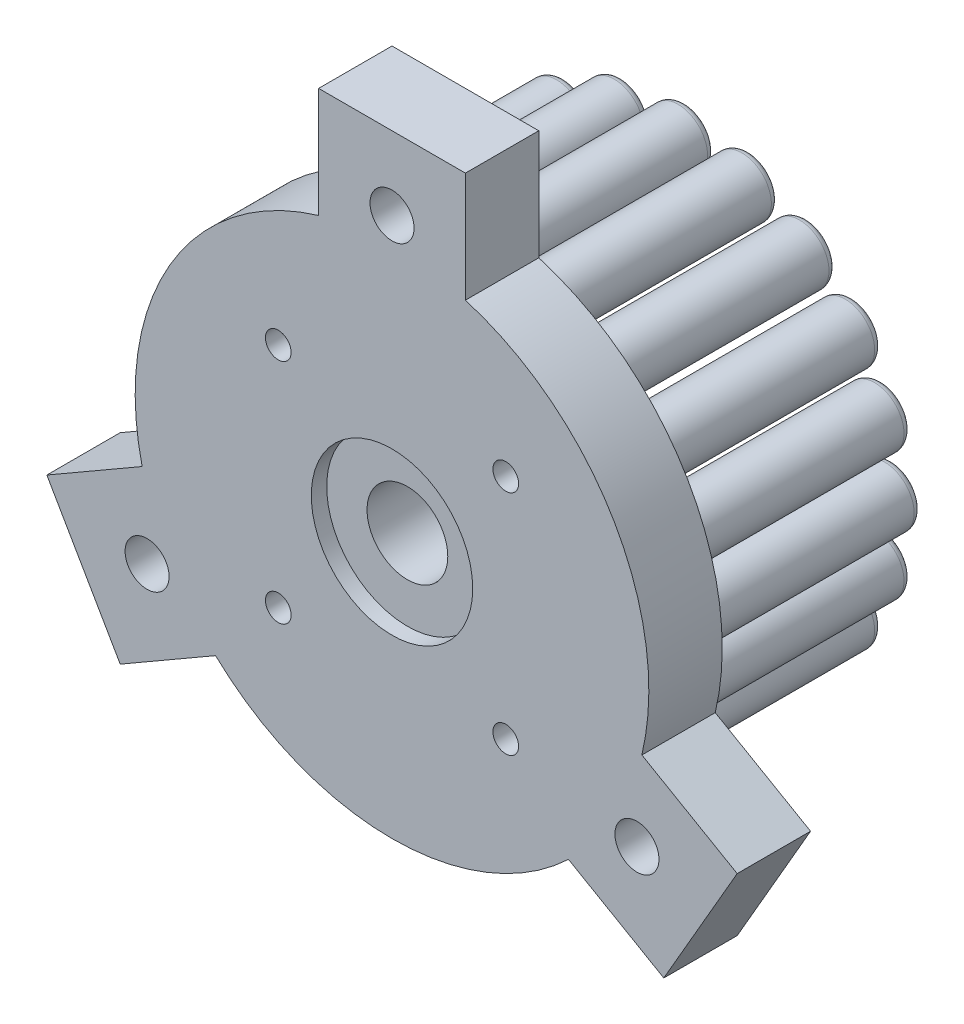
SolidWorks part; units mm, degrees
ref_plane "Ebene vorne" through (0, 0, 0) normal (0, 0, 1) x (1, 0, 0)
ref_plane "Ebene oben" through (0, 0, 0) normal (0, 1, 0) x (1, 0, 0)
ref_plane "Ebene rechts" through (0, 0, 0) normal (1, 0, 0) x (0, 0, -1)
sketch "Skizze1" plane through (0, 0, 0) normal (0, 0, 1) x (1, 0, 0)
  circle A0 centre (0, 0) radius 28.15
  circle A1 centre (0, 28.15) radius 4
  circle A2 centre (8.6988, 26.7722) radius 4
  circle A3 centre (16.5462, 22.7738) radius 4
  circle A4 centre (22.7738, 16.5462) radius 4
  circle A5 centre (26.7722, 8.6988) radius 4
  circle A6 centre (28.15, 0) radius 4
  circle A7 centre (26.7722, -8.6988) radius 4
  circle A8 centre (22.7738, -16.5462) radius 4
  circle A9 centre (16.5462, -22.7738) radius 4
  circle A10 centre (8.6988, -26.7722) radius 4
  circle A11 centre (0, -28.15) radius 4
  circle A12 centre (-8.6988, -26.7722) radius 4
  circle A13 centre (-16.5462, -22.7738) radius 4
  circle A14 centre (-22.7738, -16.5462) radius 4
  circle A15 centre (-26.7722, -8.6988) radius 4
  circle A16 centre (-28.15, 0) radius 4
  circle A17 centre (-26.7722, 8.6988) radius 4
  circle A18 centre (-22.7738, 16.5462) radius 4
  circle A19 centre (-16.5462, 22.7738) radius 4
  circle A20 centre (-8.6988, 26.7722) radius 4
  point P36 (0, 0)
  dimension "D1" = 56.3
  dimension "D2" = 20
  dimension "D3" = 8
extrude "Aufsatz-Linear austragen1" add sketch "Skizze1" along normal blind 30 contours A5 | A4 | A3 | A2 | A1 | A13 | A12 | A11 | A10 | A9 | A8 | A7 | A6 | A14 | A15 | A16 | A17 | A18 | A19 | A20
sketch "Skizze5" plane through (0, 0, 30) normal (0, 0, 1) x (1, 0, 0)
  circle A0 centre (0, 0) radius 35
  dimension "D1" = 70
extrude "Aufsatz-Linear austragen2" add sketch "Skizze5" along normal blind 10
sketch "Skizze6" plane through (0, 0, 40) normal (0, 0, 1) x (1, 0, 0)
  circle A0 centre (0, 0) radius 5.5
  dimension "D1" = 11
extrude "Schnitt-Linear austragen1" cut sketch "Skizze6" against normal blind 10
ref_plane "Ebene2" through (0, 0, 40) normal (0, 0, 1) x (1, 0, 0)
sketch "Skizze7" plane through (0, 0, 40) normal (0, 0, 1) x (1, 0, 0)
  line L1 (-10, 33.541) -> (10, 33.541)
  line L2 (-10, 33.541) -> (-10, 48.541)
  line L3 (-10, 48.541) -> (10, 48.541)
  line L4 (10, 33.541) -> (10, 48.541)
  line L12 (34.0474, -8.1103) -> (47.0378, -15.6103)
  line L13 (34.0474, -8.1103) -> (24.0474, -25.4308)
  line L14 (24.0474, -25.4308) -> (37.0378, -32.9308)
  line L15 (47.0378, -15.6103) -> (37.0378, -32.9308)
  line L16 (-24.0474, -25.4308) -> (-37.0378, -32.9308)
  line L17 (-24.0474, -25.4308) -> (-34.0474, -8.1103)
  line L18 (-34.0474, -8.1103) -> (-47.0378, -15.6103)
  line L19 (-37.0378, -32.9308) -> (-47.0378, -15.6103)
  circle A0 centre (0, 0) radius 35 construction
  point P18 (0, 0)
  dimension "D1" = 20
  dimension "D2" = 10
  dimension "D3" = 15
  dimension "D4" = 3
extrude "Aufsatz-Linear austragen3" add sketch "Skizze7" against normal blind 10
sketch "Skizze9" plane through (0, 0, 40) normal (0, 0, 1) x (1, 0, 0)
  line L0 (10, 48.541) -> (-10, 48.541) construction
  line L1 (10, 33.541) -> (10, 48.541) construction
  circle A0 centre (0, 38.541) radius 3
  circle A1 centre (33.3775, -19.2705) radius 3
  circle A2 centre (-33.3775, -19.2705) radius 3
  point P11 (0, 0)
  dimension "D1" = 6
  dimension "D2" = 10
  dimension "D4" = 10
  dimension "D3" = 3
extrude "Schnitt-Linear austragen3" cut sketch "Skizze9" against normal up to next
fillet "Verrundung2" radius 1 20 edges at (30.7722, 8.6988, 0) (-12.5462, -22.7738, 0) (-4.6988, -26.7722, 0) (4, -28.15, 0) (12.6988, -26.7722, 0) (20.5462, -22.7738, 0) (26.7738, -16.5462, 0) (30.7722, -8.6988, 0) (32.15, 0, 0) (26.7738, 16.5462, 0) (20.5462, 22.7738, 0) (12.6988, 26.7722, 0) (-18.7738, -16.5462, 0) (-22.7722, -8.6988, 0) (-24.15, 0, 0) (-22.7722, 8.6988, 0) (-18.7738, 16.5462, 0) (-12.5462, 22.7738, 0) (-4.6988, 26.7722, 0) (4, 28.15, 0)
sketch "Skizze10" plane through (0, 0, 40) normal (0, 0, 1) x (1, 0, 0)
  line L1 (-15.5, 15.5) -> (15.5, 15.5)
  line L2 (-15.5, 15.5) -> (-15.5, -15.5)
  line L3 (-15.5, -15.5) -> (15.5, -15.5)
  line L4 (15.5, 15.5) -> (15.5, -15.5)
  circle A0 centre (-15.5, 15.5) radius 1.75
  circle A1 centre (15.5, 15.5) radius 1.75
  circle A2 centre (15.5, -15.5) radius 1.75
  circle A3 centre (-15.5, -15.5) radius 1.75
  dimension "D5" = 3.5
  dimension "D1" = 31
  dimension "D2" = 31
  dimension "D3" = 15.5
  dimension "D4" = 15.5
extrude "Schnitt-Linear austragen4" cut sketch "Skizze10" against normal blind 10 contours A1 | A0 | A3 | A2
sketch "Skizze12" plane through (0, 0, 30) normal (0, 0, -1) x (-1, 0, 0)
  circle A0 centre (-15.5, 15.5) radius 3.3
  circle A1 centre (15.5, 15.5) radius 3.3
  circle A2 centre (-15.5, -15.5) radius 3.3
  circle A3 centre (15.5, -15.5) radius 3.3
extrude "Schnitt-Linear austragen5" cut sketch "Skizze12" against normal blind 3
sketch "Skizze13" plane through (0, 0, 40) normal (0, 0, 1) x (1, 0, 0)
  circle A0 centre (0, 0) radius 11
extrude "Schnitt-Linear austragen6" cut sketch "Skizze13" against normal blind 2.1
